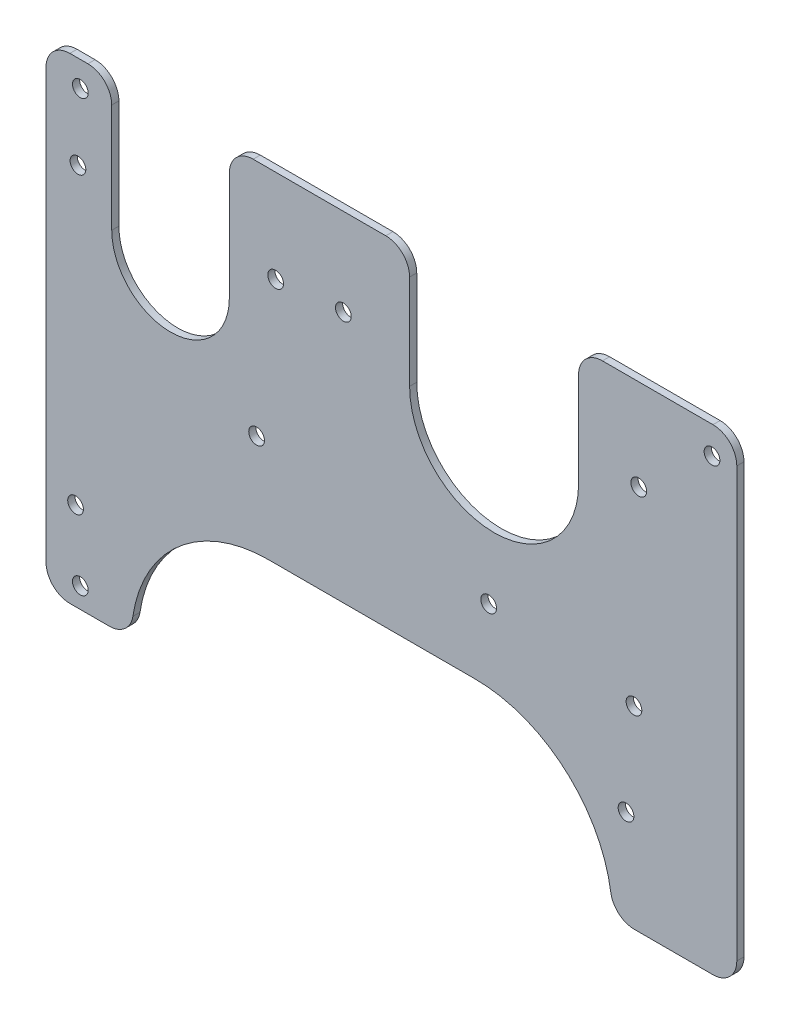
SolidWorks part; units mm, degrees
ref_plane "Přední rovina" through (0, 0, 0) normal (0, 0, 1) x (1, 0, 0)
ref_plane "Horní rovina" through (0, 0, 0) normal (0, 1, 0) x (1, 0, 0)
ref_plane "Pravá rovina" through (0, 0, 0) normal (1, 0, 0) x (0, 0, -1)
sketch "Skica1" plane through (0, 0, 0) normal (0, 0, 1) x (1, 0, 0)
  line L1 (-30.5832, 74.591) -> (114.4168, 74.591)
  line L2 (-30.5832, 74.591) -> (-30.5832, -25.409)
  line L3 (-30.5832, -25.409) -> (114.4168, -25.409)
  line L4 (114.4168, 74.591) -> (114.4168, -25.409)
  dimension "D1" = 100
  dimension "D2" = 145
extrude "Přidat vysunutím1" add sketch "Skica1" along normal blind 1.5
sketch "Skica2" plane through (0, 0, 0) normal (0, 0, -1) x (-1, 0, 0)
  circle A0 centre (23.3887, -21.109) radius 1.65
  circle A1 centre (23.3887, 69.291) radius 1.65
  circle A2 centre (-91.1613, -4.959) radius 1.65
  circle A3 centre (-109.2113, 68.791) radius 1.65
extrude "Odebrat vysunutím1" cut sketch "Skica2" against normal blind 1.5
sketch "Skica3" plane through (0, 0, 0) normal (0, 0, -1) x (-1, 0, 0)
  circle A0 centre (-17.6144, 55.1169) radius 1.65
  circle A1 centre (-13.6144, 24.6169) radius 1.65
  circle A2 centre (23.8856, 55.1169) radius 1.65
  circle A3 centre (24.3856, -6.8831) radius 1.65
  circle A4 centre (-31.8293, 56.268) radius 1.65
  circle A5 centre (-62.3293, 18.468) radius 1.65
  circle A6 centre (-93.8293, 55.468) radius 1.65
  circle A7 centre (-92.8293, 15.168) radius 1.65
extrude "Odebrat vysunutím2" cut sketch "Skica3" against normal through all
sketch "Skica4" plane through (0, 0, 1.5) normal (0, 0, 1) x (1, 0, 0)
  line L0 (-4.45, 46.8278) -> (-4.45, 74.591) construction
  line L1 (114.4168, 74.591) -> (-30.5832, 74.591) construction
  line L2 (-16.7917, 46.8278) -> (-16.7917, 74.591)
  line L3 (7.8917, 46.8278) -> (7.8917, 74.591)
  line L4 (63.4692, 49.7199) -> (63.4692, 74.591) construction
  line L5 (45.7331, 49.7199) -> (45.7331, 74.591)
  line L6 (81.2053, 49.7199) -> (81.2053, 74.591)
  line L7 (16.129, -25.409) -> (59.4783, -25.409) construction
  line L8 (16.129, 3.3971) -> (59.4783, 3.3971)
  line L9 (16.129, -54.2151) -> (59.4783, -54.2151)
  line L10 (-30.5832, -25.409) -> (114.4168, -25.409) construction
  arc A0 (-16.7917, 46.8278) -> (7.8917, 46.8278) centre (-4.45, 46.8278) ccw
  arc A1 (7.8917, 74.591) -> (-16.7917, 74.591) centre (-4.45, 74.591) ccw
  arc A2 (45.7331, 49.7199) -> (81.2053, 49.7199) centre (63.4692, 49.7199) ccw
  arc A3 (81.2053, 74.591) -> (45.7331, 74.591) centre (63.4692, 74.591) ccw
  arc A4 (16.129, 3.3971) -> (16.129, -54.2151) centre (16.129, -25.409) ccw
  arc A5 (59.4783, -54.2151) -> (59.4783, 3.3971) centre (59.4783, -25.409) ccw
  point P4 (-4.45, 60.7094)
  point P9 (63.4692, 62.1554)
  point P18 (37.8036, -25.409)
extrude "Odebrat vysunutím3" cut sketch "Skica4" against normal through all
fillet "Zaoblit2" radius 5 10 edges at (-30.5832, -25.409, 0.75) (-12.6771, -25.409, 0.75) (88.2844, -25.409, 0.75) (114.4168, -25.409, 0.75) (114.4168, 74.591, 0.75) (81.2053, 74.591, 0.75) (45.7331, 74.591, 0.75) (7.8917, 74.591, 0.75) (-16.7917, 74.591, 0.75) (-30.5832, 74.591, 0.75)
